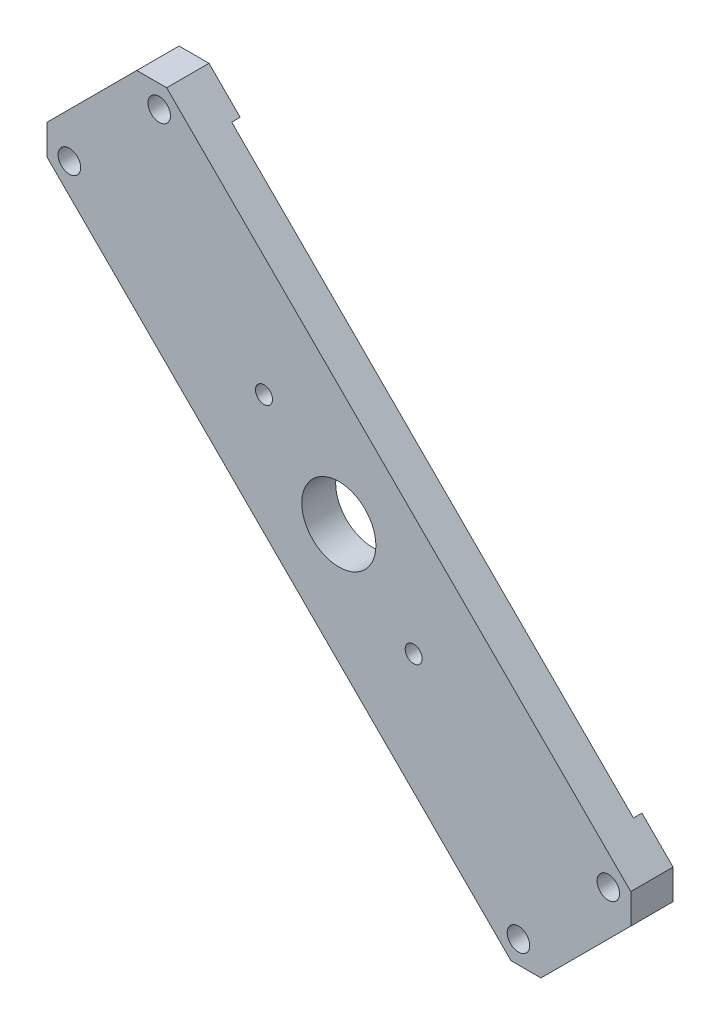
SolidWorks part; units mm, degrees
ref_plane "Front Plane" through (0, 0, 0) normal (0, 0, 1) x (1, 0, 0)
ref_plane "Top Plane" through (0, 0, 0) normal (0, 1, 0) x (1, 0, 0)
ref_plane "Right Plane" through (0, 0, 0) normal (1, 0, 0) x (0, 0, -1)
sketch "Sketch1" plane through (0, 0, 0) normal (0, 0, 1) x (1, 0, 0)
  line L1 (-157.2186, -9.5524) -> (-9.0444, -157.7266)
  line L2 (-9.0444, -157.7266) -> (-44.9654, -193.6476)
  line L3 (-193.1396, -45.4734) -> (-157.2186, -9.5524)
  line L4 (-101.092, -101.6) -> (-101.092, -23.2126) construction
  line L5 (-101.092, -101.6) -> (-148.0343, -54.6577) construction
  line L6 (-101.092, -101.6) -> (-101.092, -169.4815) construction
  line L7 (-44.9654, -193.6476) -> (-193.1396, -45.4734)
  circle A0 centre (-181.9143, -47.7185) radius 3.3782
  circle A1 centre (-154.9735, -20.7777) radius 3.3782
  circle A2 centre (-47.2105, -182.4223) radius 3.3782
  circle A3 centre (-20.2697, -155.4815) radius 3.3782
  circle A4 centre (-101.092, -101.6) radius 11.1125
  dimension "D1" = 6.7564
  dimension "D2" = 6.7564
  dimension "D3" = 6.7564
  dimension "D4" = 6.7564
  dimension "D6" = 90
  dimension "D11" = 22.225
  dimension "D5" = 25.4
  dimension "D7" = 45
  dimension "D8" = 25.4
  dimension "D9" = 104.775
  dimension "D10" = 104.775
extrude "block" add sketch "Sketch1" along normal blind 12.7
sketch "Sketch2" plane through (0, 0, 0) normal (0, 0, -1) x (-1, 0, 0)
  circle A0 centre (101.092, -101.6) radius 88.9
  dimension "D1" = 177.8
extrude "bottom relief" cut sketch "Sketch2" against normal blind 2.54
chamfer "corners" distance 6.35 angle 45 4 edges at (-44.9654, -193.6476, 6.35) (-193.1396, -45.4734, 6.35) (-157.2186, -9.5524, 6.35) (-9.0444, -157.7266, 6.35)
sketch "Sketch3" plane through (0, 0, 2.54) normal (0, 0, -1) x (-1, 0, 0)
  line L0 (101.092, -101.6) -> (175.1791, -27.5129) construction
  line L1 (161.7087, -14.0425) -> (188.6495, -40.9833) construction
  line L2 (175.1791, -27.5129) -> (27.0049, -175.6871) construction
  line L3 (40.4753, -189.1575) -> (13.5345, -162.2167) construction
  line L4 (110.9861, -21.6916) -> (178.7513, -89.4567) construction
  line L5 (20.6149, -110.9254) -> (82.9179, -173.2285) construction
  line L6 (144.808, -35.4334) -> (33.9791, -146.2623) construction
  line L7 (166.6784, -58.4643) -> (56.5782, -168.5644) construction
  circle A0 centre (134.768, -45.4734) radius 4.064
  circle A1 centre (157.2186, -67.924) radius 4.064
  circle A2 centre (44.9654, -135.276) radius 4.064
  circle A3 centre (67.416, -157.7266) radius 4.064
  dimension "D5" = 8.128
  dimension "D6" = 8.128
  dimension "D7" = 8.128
  dimension "D8" = 8.128
  dimension "D1" = 63.5
  dimension "D2" = 127
  dimension "D3" = 31.75
  dimension "D4" = 15.875
extrude "spring cbores" cut sketch "Sketch3" against normal blind 0.762
hole_wizard "1/4-20 Tapped flush valve" positions "Sketch4" profile "Sketch5" tap size "1/4-20" standard "ANSI Inch"
sketch "Sketch4" plane through (0, 0, 12.7) normal (0, 0, 1) x (1, 0, 0)
  line L0 (-175.1791, -27.5129) -> (-27.0049, -175.6871) construction
  line L1 (-161.7087, -14.0425) -> (-188.6495, -40.9833) construction
  line L2 (-40.4753, -189.1575) -> (-13.5345, -162.2167) construction
  circle A0 centre (-101.092, -101.6) radius 11.1125 construction
  point P10 (-123.5426, -79.1494)
  point P12 (-78.6414, -124.0506)
  dimension "D2" = 31.75
  dimension "D1" = 63.5
sketch "Sketch5" plane through (-78.6414, -124.0506, 12.7) normal (1, 0, 0) x (0, -1, 0)
  line L0 (0, 0) -> (0, 12.7)
  line L1 (0, 12.7) -> (2.5527, 12.7)
  line L2 (2.5527, 12.7) -> (2.5527, 0)
  line L5 (2.5527, 0) -> (0, 0)
  line L11 (0, -6.35) -> (0, 107.95) construction
  dimension "Thru Tap Drill Dia." = 5.1054
  dimension "Thru Tap Drill Depth" = 12.7
